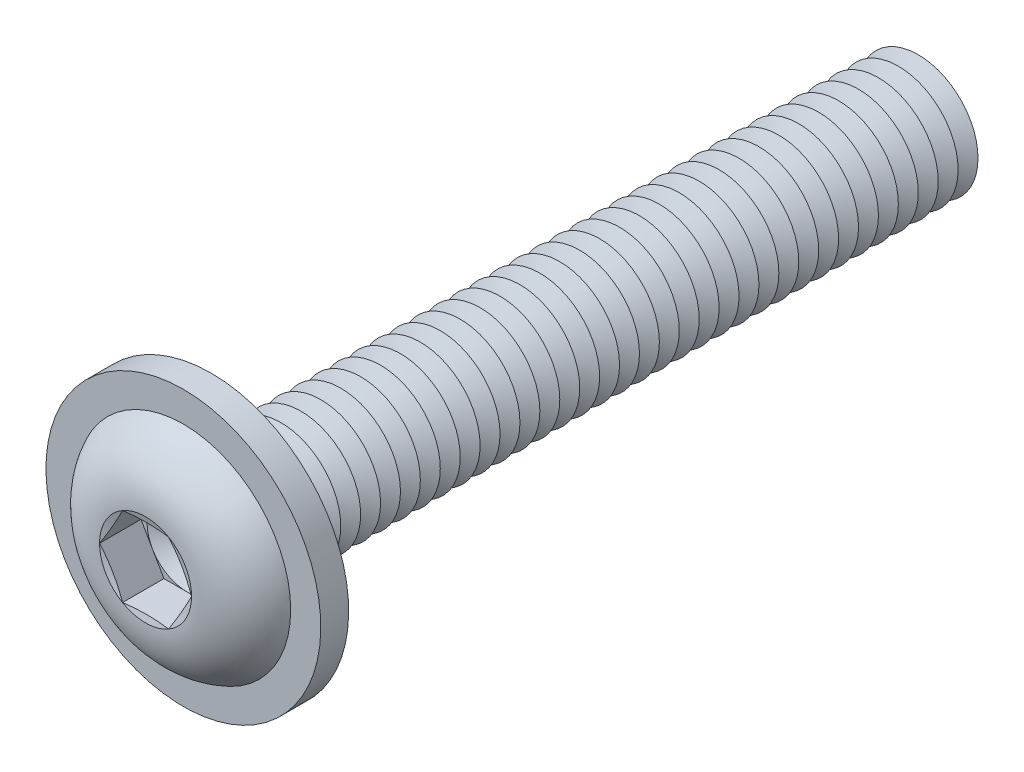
SolidWorks part; units mm, degrees
ref_plane "Front Plane" through (0, 0, 0) normal (0, 0, 1) x (1, 0, 0)
ref_plane "Top Plane" through (0, 0, 0) normal (0, 1, 0) x (1, 0, 0)
ref_plane "Right Plane" through (0, 0, 0) normal (1, 0, 0) x (0, 0, -1)
sketch "Sketch1" plane through (0, 0, 0) normal (1, 0, 0) x (0, 0, -1)
  line L0 (0, 1.5) -> (0, 2.85)
  line L3 (0, 1.5) -> (18, 1.5)
  line L4 (18, 1.5) -> (18, 0)
  line L5 (18, 0) -> (-1.65, 0) construction
  line L6 (-1.65, 0) -> (18, 0)
  line L7 (-1.65, 1.1547) -> (-1.65, 0.5773) construction
  line L8 (-1.65, 0.5773) -> (-1.65, 0)
  line L9 (-1.65, 1.1547) -> (-1.4953, 0.5773)
  line L10 (-1.4953, 0.5773) -> (-1.65, 0.5773)
  line L11 (18, 0) -> (22.7481, 0) construction
  line L12 (0, 2.85) -> (-1.65, 2.85) construction
  arc A1 (0, 2.85) -> (-1.65, 1.1547) centre (0, 1.1994) ccw
  point P8 (18, 0.75)
  dimension "D1" = 5.7
  dimension "D2" = 3
  dimension "D3" = 1.65
  dimension "D4" = 2.3094
  dimension "D5" = 18
  dimension "D6" = 15
revolve "Revolve1" add sketch "Sketch1" angle 360 about L5
fillet "Fillet1" radius 0.25 1 edges at (-1.5, 0, 0)
sketch "Sketch2" plane through (0, 0, 0) normal (1, 0, 0) x (0, 0, -1)
  line L0 (17.75, 1.5) -> (18.25, 1.5)
  line L1 (18, 1.5) -> (0.25, 1.5) construction
  line L2 (18.25, 1.5) -> (18, 1.067)
  line L3 (18, -1.5) -> (18, 1.5) construction
  line L4 (18, 1.067) -> (17.75, 1.5)
  dimension "D1" = 0.5
revolve "Cut-Revolve1" cut sketch "Sketch2" angle 360 about axis through (0, 0, -18) along (0, 0, -1)
pattern_linear "LPattern1" count 36 spacing 0.5 along (0, 0, 1) of "Cut-Revolve1"
sketch "Sketch3" plane through (0, 0, 1.65) normal (0, 0, 1) x (1, 0, 0)
  line L7 (0.5773, 1) -> (-0.5774, 1)
  line L8 (-0.5774, 1) -> (-1.1547, 0)
  line L9 (-1.1547, 0) -> (-0.5773, -1)
  line L10 (-0.5773, -1) -> (0.5773, -1)
  line L11 (0.5773, -1) -> (1.1547, 0)
  line L12 (1.1547, 0) -> (0.5773, 1)
  circle A0 centre (0, 0) radius 1 construction
  circle A3 centre (0, 0) radius 1.1547 construction
extrude "Cut-Extrude1" cut sketch "Sketch3" against normal blind 1.04
sketch "Sketch4" plane through (0, 0, 0.61) normal (0, 0, 1) x (1, 0, 0)
  line L1 (0.5773, 1) -> (-0.5774, 1) construction
  circle A0 centre (0, 0) radius 1
extrude "Cut-Extrude2" cut sketch "Sketch4" against normal through all draft 60
sketch "Sketch5" plane through (0, 0, 0) normal (0, 0, -1) x (-1, 0, 0)
  circle A0 centre (0, 0) radius 3.45
  circle A1 centre (0, 0) radius 1.75
  circle A2 centre (0, 0) radius 1.75 construction
  dimension "D1" = 6.9
extrude "Boss-Extrude1" add sketch "Sketch5" against normal blind 0.7
